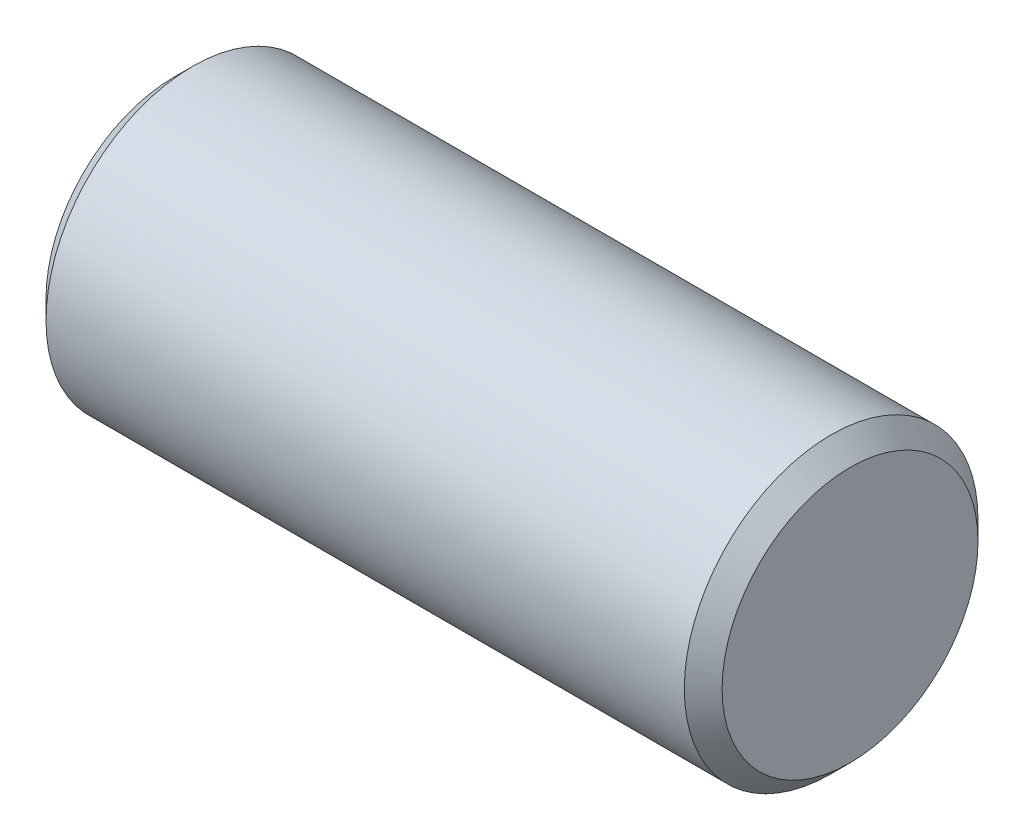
SolidWorks part; units mm, degrees
ref_plane "Front Plane" through (0, 0, 0) normal (0, 0, 1) x (1, 0, 0)
ref_plane "Top Plane" through (0, 0, 0) normal (0, 1, 0) x (1, 0, 0)
ref_plane "Right Plane" through (0, 0, 0) normal (1, 0, 0) x (0, 0, -1)
sketch "Sketch1" plane through (0, 0, 0) normal (0, 0, 1) x (1, 0, 0)
  line L0 (0, 0) -> (50000, 0) construction
  line L1 (0, 0) -> (0, 1.7209)
  line L2 (0.254, 1.9749) -> (8.8392, 1.9749)
  line L3 (9.0932, 1.7209) -> (9.0932, 0)
  line L4 (0, 0) -> (9.0932, 0)
  line L5 (0, 1.7209) -> (0.254, 1.9749)
  line L6 (8.8392, 1.9749) -> (9.0932, 1.7209)
  point P4 (0, 1.9749)
  point P6 (9.0932, 1.9749)
  dimension "D1" = 9.0932
  dimension "D2" = 1.9748
  dimension "D3" = 0.254
  dimension "D4" = 45
  dimension "D5" = 0.254
  dimension "D6" = 45
revolve "Revolve1" add sketch "Sketch1" angle 360 about L0
